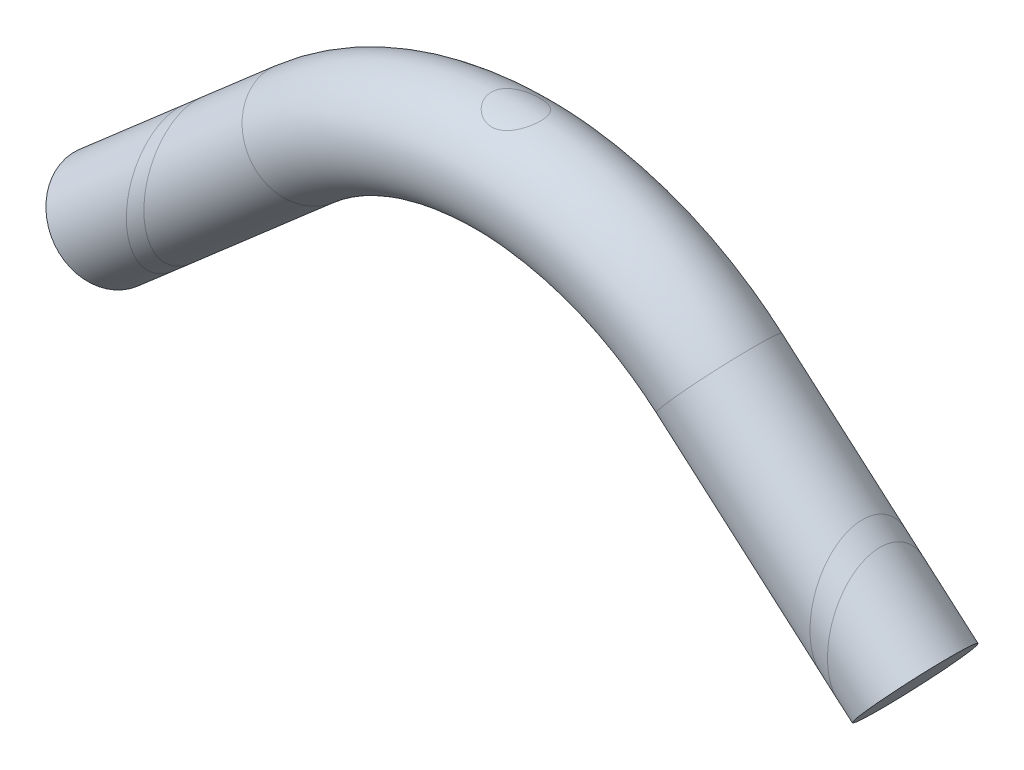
SolidWorks part; units mm, degrees
ref_plane "Front Plane" through (0, 0, 0) normal (0, 0, 1) x (1, 0, 0)
ref_plane "Top Plane" through (0, 0, 0) normal (0, 1, 0) x (1, 0, 0)
ref_plane "Right Plane" through (0, 0, 0) normal (1, 0, 0) x (0, 0, -1)
sketch "Sketch1" plane through (0, 0, 0) normal (0, 0, 1) x (1, 0, 0)
  line L0 (0, 0) -> (230, 0) construction
  line L1 (115, 0) -> (115, 70) construction
  line L2 (115, 70) -> (115, 100) construction
  line L3 (0, 0) -> (55.9439, 48.6469)
  line L4 (230, 0) -> (174.0561, 48.6469)
  arc A0 (174.0561, 48.6469) -> (55.9439, 48.6469) centre (115, -19.2676) ccw
  point P9 (115, 70.7324)
  dimension "D2" = 70
  dimension "D4" = 90
  dimension "D1" = 230
  dimension "D3" = 30
ref_plane "Plane1" through (115, 0, 0) normal (1, 0, 0) x (0, 0, -1)
sketch "Sketch3" plane through (115, 0, 0) normal (1, 0, 0) x (0, 0, -1)
  circle A0 centre (0, 70.7324) radius 15
sweep "Sweep1" add profiles "Sketch3" path "Sketch1"
mirror "Mirror1" about plane through (115, 0, 0) normal (1, 0, 0) of "Sweep1"
sketch "Sketch4" plane through (0, 0, 0) normal (0, 1, 0) x (1, 0, 0)
  circle A0 centre (116.1146, 0) radius 7
sketch "Sketch6" plane through (0, 0, 0) normal (0, 0, 1) x (1, 0, 0)
  line L0 (20, 110.4303) -> (20, -23.3284)
  line L1 (25, 110.4303) -> (25, -23.3284)
  line L2 (215, 104.879) -> (215, -19.0989)
  line L3 (220, 104.879) -> (220, -19.0989)
  line L4 (115, -16.5) -> (115, 16.5) construction
sketch "Sketch7" plane through (115, 0, 0) normal (1, 0, 0) x (0, 0, -1)
  line L0 (0, 0) -> (8.7261, 32.5661)
  line L1 (0, 0) -> (0, 40.0257) construction
  dimension "D1" = 15
equation "\"D4@Sketch6\"=\"D3@Sketch6\"/2"
